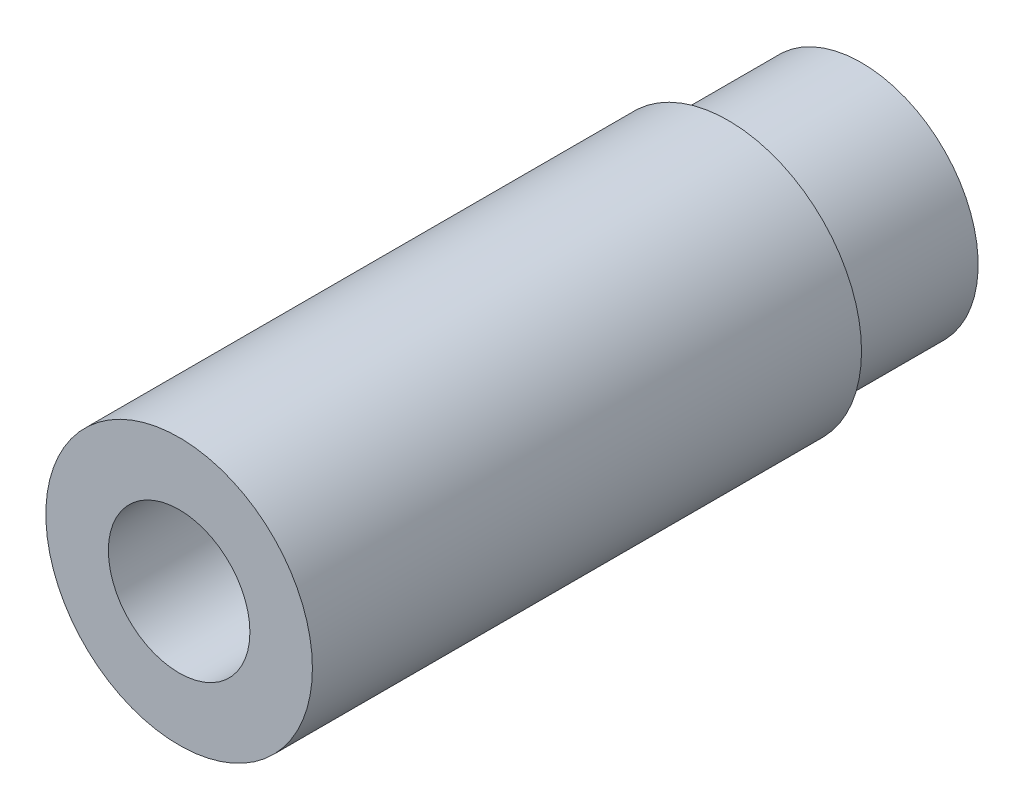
SolidWorks part; units mm, degrees
ref_plane "Front Plane" through (0, 0, 0) normal (0, 0, 1) x (1, 0, 0)
ref_plane "Top Plane" through (0, 0, 0) normal (0, 1, 0) x (1, 0, 0)
ref_plane "Right Plane" through (0, 0, 0) normal (1, 0, 0) x (0, 0, -1)
sketch "Sketch1" plane through (0, 0, 0) normal (0, 0, 1) x (1, 0, 0)
  circle A0 centre (0, 0) radius 12.7
  dimension "D1" = 25.4
extrude "Boss-Extrude1" add sketch "Sketch1" along normal blind 52.324
sketch "Sketch2" plane through (0, 0, 0) normal (0, 0, -1) x (-1, 0, 0)
  circle A0 centre (0, 0) radius 6.7437
  dimension "D1" = 13.4874
extrude "Cut-Extrude1" cut sketch "Sketch2" against normal up to next
sketch "Sketch3" plane through (0, 0, 0) normal (0, 0, -1) x (-1, 0, 0)
  circle A0 centre (0, 0) radius 11.1125
  circle A1 centre (0, 0) radius 6.7437
  circle A2 centre (0, 0) radius 6.7437 construction
  dimension "D1" = 22.225
extrude "Boss-Extrude2" add sketch "Sketch3" along normal blind 12.7 contours A0 | A1
